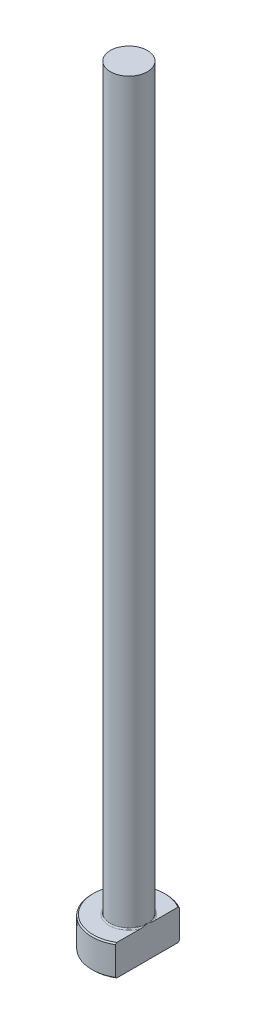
SolidWorks part; units mm, degrees
ref_plane "Front Plane" through (0, 0, 0) normal (0, 0, 1) x (1, 0, 0)
ref_plane "Top Plane" through (0, 0, 0) normal (0, 1, 0) x (1, 0, 0)
ref_plane "Right Plane" through (0, 0, 0) normal (1, 0, 0) x (0, 0, -1)
sketch "Sketch1" plane through (0, 0, 0) normal (0, 0, 1) x (1, 0, 0)
  line L0 (0, 259.9588) -> (0, -15.1925) construction
  line L1 (0, 0) -> (-6, 0)
  line L2 (-6, 0) -> (-6, 5)
  line L3 (-6, 5) -> (-3, 5)
  line L4 (-3, 5) -> (-3, 125)
  line L5 (-3, 125) -> (0, 125)
  line L6 (0, 125) -> (0, 0)
  dimension "L" = 125
  dimension "H" = 12
  dimension "T" = 5
  dimension "D" = 6
revolve "Revolve1" add sketch "Sketch1" angle 360 about L0
chamfer "Chamfer1" distance 0.2 angle 45 2 edges at (0, 5, 6) (0, 0, 6)
fillet "Fillet1" radius 0.2 1 edges at (0, 5, 3)
sketch "Sketch2" plane through (0, 0, 0) normal (0, 1, 0) x (1, 0, 0)
  line L0 (3, 5.1962) -> (3, -5.1962)
  circle A0 centre (0, 0) radius 6 construction
  arc A1 (3, -5.1962) -> (3, 5.1962) centre (0, 0) ccw
  circle A2 centre (0, 0) radius 3 construction
extrude "KEY" cut sketch "Sketch2" along normal through all
